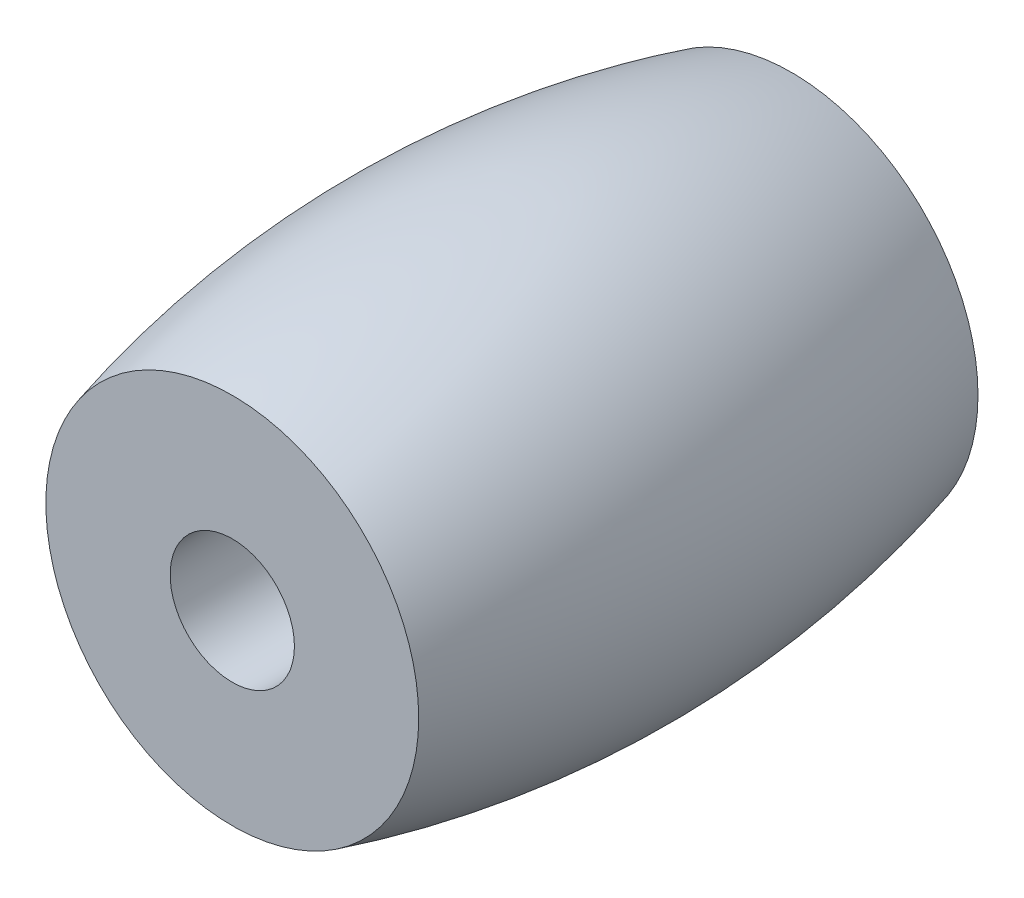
SolidWorks part; units mm, degrees
ref_plane "前视基准面" through (0, 0, 0) normal (0, 0, 1) x (1, 0, 0)
ref_plane "上视基准面" through (0, 0, 0) normal (0, 1, 0) x (1, 0, 0)
ref_plane "右视基准面" through (0, 0, 0) normal (1, 0, 0) x (0, 0, -1)
sketch "草图1" plane through (0, 0, 0) normal (0, 1, 0) x (1, 0, 0)
  line L0 (4.5, 6.75) -> (1.5, 6.75)
  line L1 (1.5, 6.75) -> (1.5, -6.75)
  line L2 (1.5, -6.75) -> (4.5, -6.75)
  line L3 (0, 6.75) -> (0, -6.75) construction
  arc A0 (4.5, -6.75) -> (4.5, 6.75) centre (-20.3625, 0) ccw
revolve "旋转1" add sketch "草图1" angle 360 about L3
